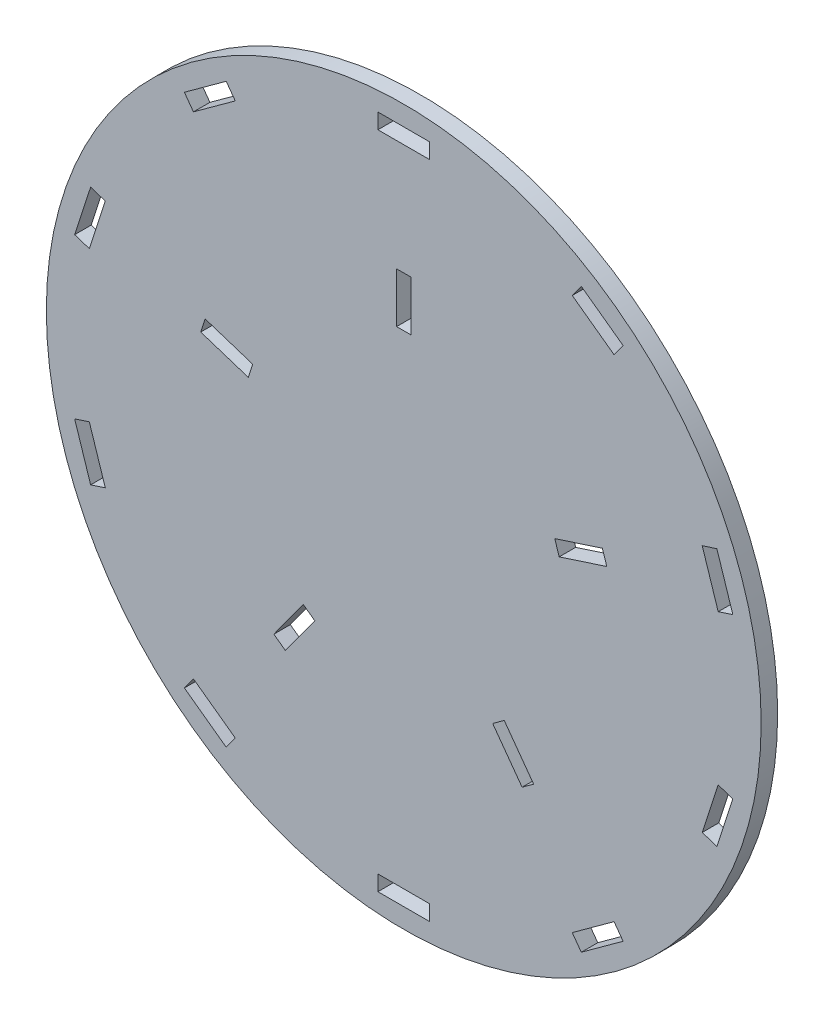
SolidWorks part; units mm, degrees
ref_plane "Front Plane" through (0, 0, 0) normal (0, 0, 1) x (1, 0, 0)
ref_plane "Top Plane" through (0, 0, 0) normal (0, 1, 0) x (1, 0, 0)
ref_plane "Right Plane" through (0, 0, 0) normal (1, 0, 0) x (0, 0, -1)
sketch "Sketch1" plane through (0, 0, 0) normal (0, 0, 1) x (1, 0, 0)
  line L0 (-4.7, 58.6) -> (-4.7, 61.4)
  line L5 (30.6418, 50.171) -> (38.2466, 44.6458)
  line L6 (38.2466, 44.6458) -> (39.8924, 46.9111)
  line L7 (-4.8, 58.5) -> (4.8, 58.5) construction
  line L8 (-4.8, 58.5) -> (-4.8, 61.5) construction
  line L9 (-4.8, 61.5) -> (4.8, 61.5) construction
  line L10 (4.8, 58.5) -> (4.8, 61.5) construction
  line L11 (-4.8, 58.5) -> (4.8, 61.5) construction
  line L12 (-4.8, 61.5) -> (4.8, 58.5) construction
  line L13 (-4.7, 61.4) -> (4.7, 61.4)
  line L14 (4.7, 58.6) -> (4.7, 61.4)
  line L15 (-4.7, 58.6) -> (4.7, 58.6)
  line L16 (32.2876, 52.4362) -> (39.8924, 46.9111)
  line L17 (30.6418, 50.171) -> (32.2876, 52.4362)
  line L18 (54.2795, 22.5784) -> (57.1843, 13.6384)
  line L19 (57.1843, 13.6384) -> (59.8472, 14.5037)
  line L20 (56.9425, 23.4436) -> (59.8472, 14.5037)
  line L21 (54.2795, 22.5784) -> (56.9425, 23.4436)
  line L22 (57.1843, -13.6384) -> (54.2795, -22.5784)
  line L23 (54.2795, -22.5784) -> (56.9425, -23.4436)
  line L24 (59.8472, -14.5037) -> (56.9425, -23.4436)
  line L25 (57.1843, -13.6384) -> (59.8472, -14.5037)
  line L26 (38.2466, -44.6458) -> (30.6418, -50.171)
  line L27 (30.6418, -50.171) -> (32.2876, -52.4362)
  line L28 (39.8924, -46.9111) -> (32.2876, -52.4362)
  line L29 (38.2466, -44.6458) -> (39.8924, -46.9111)
  line L30 (4.7, -58.6) -> (-4.7, -58.6)
  line L31 (-4.7, -58.6) -> (-4.7, -61.4)
  line L32 (4.7, -61.4) -> (-4.7, -61.4)
  line L33 (4.7, -58.6) -> (4.7, -61.4)
  line L34 (-30.6418, -50.171) -> (-38.2466, -44.6458)
  line L35 (-38.2466, -44.6458) -> (-39.8924, -46.9111)
  line L36 (-32.2876, -52.4362) -> (-39.8924, -46.9111)
  line L37 (-30.6418, -50.171) -> (-32.2876, -52.4362)
  line L38 (-54.2795, -22.5784) -> (-57.1843, -13.6384)
  line L39 (-57.1843, -13.6384) -> (-59.8472, -14.5037)
  line L40 (-56.9425, -23.4436) -> (-59.8472, -14.5037)
  line L41 (-54.2795, -22.5784) -> (-56.9425, -23.4436)
  line L42 (-57.1843, 13.6384) -> (-54.2795, 22.5784)
  line L43 (-54.2795, 22.5784) -> (-56.9425, 23.4436)
  line L44 (-59.8472, 14.5037) -> (-56.9425, 23.4436)
  line L45 (-57.1843, 13.6384) -> (-59.8472, 14.5037)
  line L46 (-38.2466, 44.6458) -> (-30.6418, 50.171)
  line L47 (-30.6418, 50.171) -> (-32.2876, 52.4362)
  line L48 (-39.8924, 46.9111) -> (-32.2876, 52.4362)
  line L49 (-38.2466, 44.6458) -> (-39.8924, 46.9111)
  line L53 (-1.5, 29.1) -> (1.5, 29.1) construction
  line L54 (-1.5, 29.1) -> (-1.5, 38.6) construction
  line L55 (-1.5, 38.6) -> (1.5, 38.6) construction
  line L56 (1.5, 29.1) -> (1.5, 38.6) construction
  line L57 (-1.5, 29.1) -> (1.5, 38.6) construction
  line L58 (-1.5, 38.6) -> (1.5, 29.1) construction
  line L75 (-1.3, 38.4) -> (1.3, 38.4)
  line L76 (1.3, 29.3) -> (1.3, 38.4)
  line L77 (-1.3, 29.3) -> (1.3, 29.3)
  line L78 (-1.3, 29.3) -> (-1.3, 38.4)
  line L79 (36.1188, 13.1026) -> (36.9223, 10.6299)
  line L80 (28.2677, 7.8178) -> (36.9223, 10.6299)
  line L81 (27.4642, 10.2906) -> (28.2677, 7.8178)
  line L82 (27.4642, 10.2906) -> (36.1188, 13.1026)
  line L83 (23.6227, -30.3021) -> (21.5192, -31.8304)
  line L84 (16.1704, -24.4683) -> (21.5192, -31.8304)
  line L85 (18.2738, -22.9401) -> (16.1704, -24.4683)
  line L86 (18.2738, -22.9401) -> (23.6227, -30.3021)
  line L87 (-21.5192, -31.8304) -> (-23.6227, -30.3021)
  line L88 (-18.2738, -22.9401) -> (-23.6227, -30.3021)
  line L89 (-16.1704, -24.4683) -> (-18.2738, -22.9401)
  line L90 (-16.1704, -24.4683) -> (-21.5192, -31.8304)
  line L91 (-36.9223, 10.6299) -> (-36.1188, 13.1026)
  line L92 (-27.4642, 10.2906) -> (-36.1188, 13.1026)
  line L93 (-28.2677, 7.8178) -> (-27.4642, 10.2906)
  line L94 (-28.2677, 7.8178) -> (-36.9223, 10.6299)
  circle A0 centre (0, 0) radius 65
  point P0 (0, 0)
  point P4 (0, 33.85)
  point P5 (0, 60)
  point P52 (0, 0)
  point P73 (0, 0)
  point P78 (0, 0)
extrude "Boss-Extrude1" add sketch "Sketch1" along normal blind 3
equation "\"Thick\" = 3"
equation "\"h\"= 3"
equation "\"kerf\" = .2"
equation "\"Length\"= \"Thick\""
equation "\"Deflection\"= .4 * \"Thick\""
equation "\"Strain\"= \"Deflection\" / \"Length\""
equation "\"Per_def\"= 1.09 * ( \"Strain\" * \"Length\" * \"Length\" ) / \"h\""
equation "\"D1@Sketch1\"= \"d1\" + \"kerf\" / 2"
equation "\"D2@Sketch1\"=\"Thick\""
equation "\"D5@Sketch1\"=\"kerf\"/2"
equation "\"D1@Boss-Extrude1\"=\"Thick\""
equation "\"circulo_ext\"=130"
equation "\"dist_corte_ext\"=60"
equation "\"D3@Sketch1\"=\"dist_corte_ext\""
equation "\"d1\" = 9.5"
equation "\"D7@Sketch1\" = \"d1\""
equation "\"d2\"= \"Thick\""
equation "\"D8@Sketch1\"=\"d2\""
equation "\"d3_dist_circulo_trasero\"=20"
equation "\"D9@Sketch1\"=\"d3_dist_circulo_trasero\""
equation "\"D11@Sketch1\"=\"kerf\""
